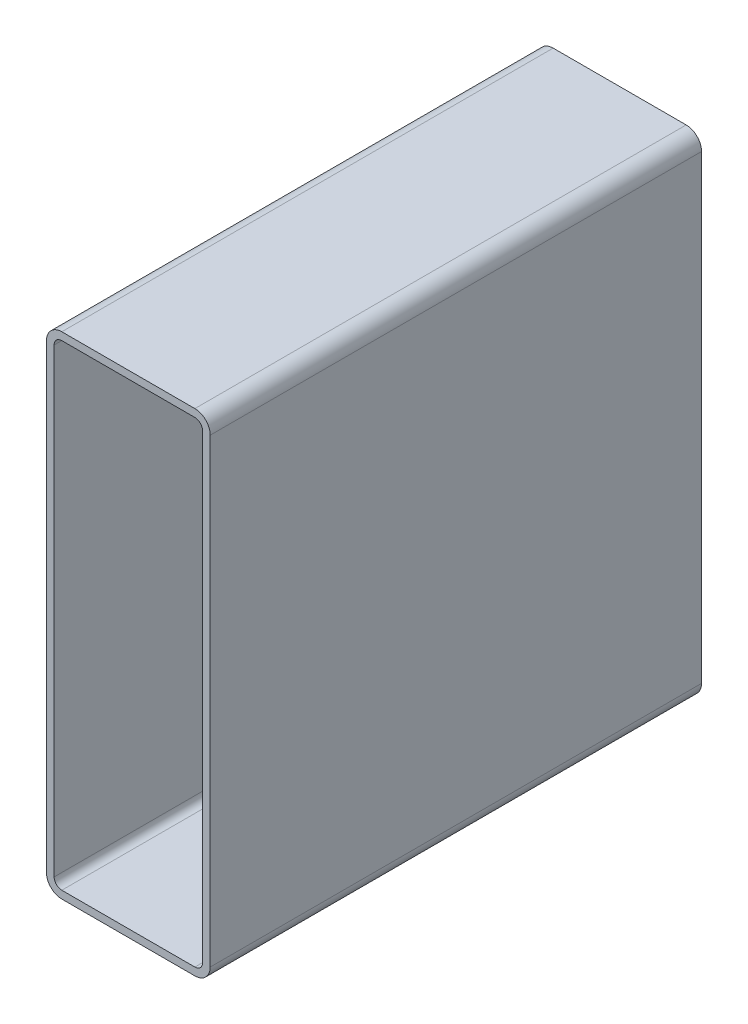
SolidWorks part; units mm, degrees
ref_plane "Front Plane" through (0, 0, 0) normal (0, 0, 1) x (1, 0, 0)
ref_plane "Top Plane" through (0, 0, 0) normal (0, 1, 0) x (1, 0, 0)
ref_plane "Right Plane" through (0, 0, 0) normal (1, 0, 0) x (0, 0, -1)
sketch "Sketch1" plane through (0, 0, 0) normal (0, 0, 1) x (1, 0, 0)
sketch_block_instance "HSS12x4x0.1875-1"
sketch_block "HSS12x4x0.1875"
extrude "Boss-Extrude1" add sketch "Sketch1" along normal blind 304.8
